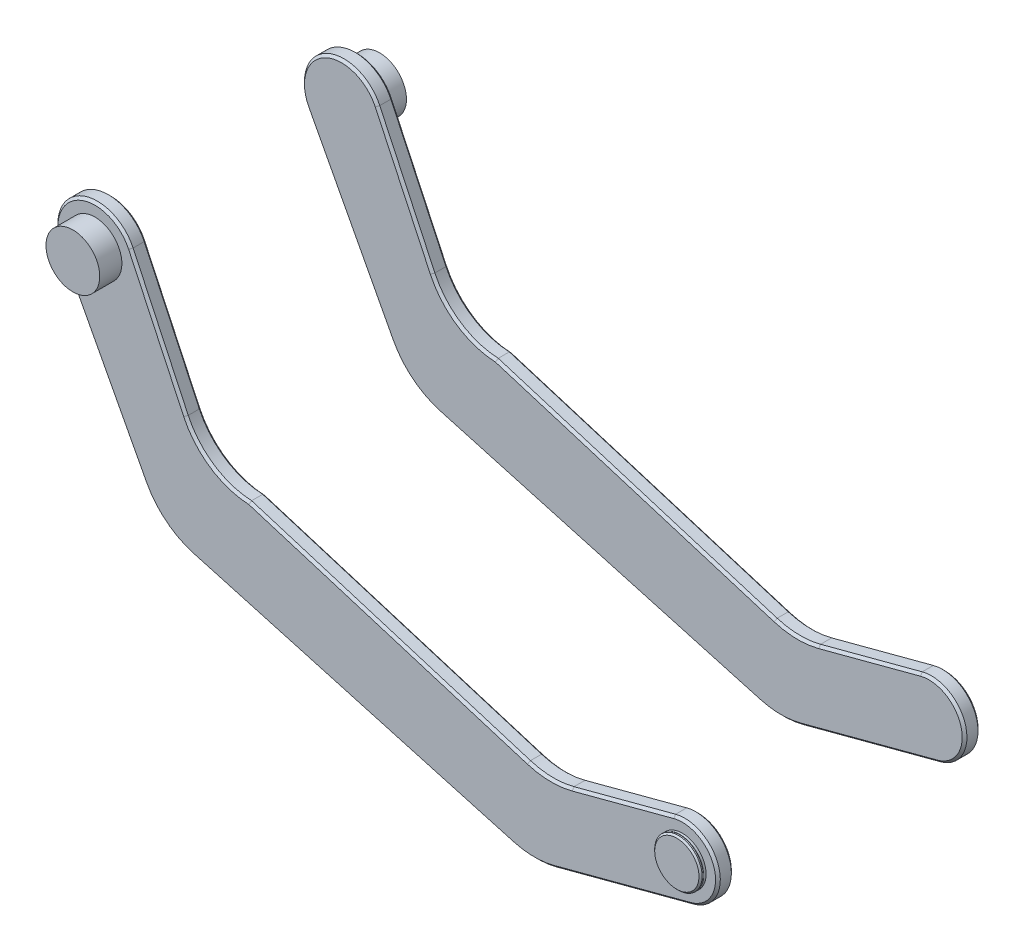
SolidWorks part; units mm, degrees
ref_plane "Front" through (0, 0, 0) normal (0, 0, 1) x (1, 0, 0)
ref_plane "Top" through (0, 0, 0) normal (0, 1, 0) x (1, 0, 0)
ref_plane "Right" through (0, 0, 0) normal (1, 0, 0) x (0, 0, -1)
imported_body "Defeature ausgeführt1"
imported_body "Defeature ausgeführt2"
imported_body "Defeature ausgeführt3"
imported_body "Defeature ausgeführt4"
imported_body "Defeature ausgeführt5"
imported_body "Defeature ausgeführt6"
other "Fläche löschen1"
other "Fläche löschen4"
other "Fläche löschen5"
other "Fläche löschen6"
other "Fläche löschen9"
other "Fläche löschen10"
sketch "Skizze1" plane through (0, 0, 83) normal (0, 0, 1) x (1, 0, 0)
  circle A0 centre (-42.3423, -225.1615) radius 17
  arc A1 (-21.0698, -215.1749) -> (-63.1134, -236.1528) centre (-42.3423, -225.1615) ccw construction
  dimension "D1" = 34
extrude "Aufsatz-Linear austragen1" add sketch "Skizze1" along normal blind 14
sketch "Skizze2" plane through (0, 0, -83) normal (0, 0, -1) x (-1, 0, 0)
  circle A0 centre (42.3423, -225.1615) radius 17
  arc A1 (63.1134, -236.1528) -> (21.0698, -215.1749) centre (42.3423, -225.1615) ccw construction
  dimension "D1" = 34
extrude "Aufsatz-Linear austragen2" add sketch "Skizze2" along normal blind 14
